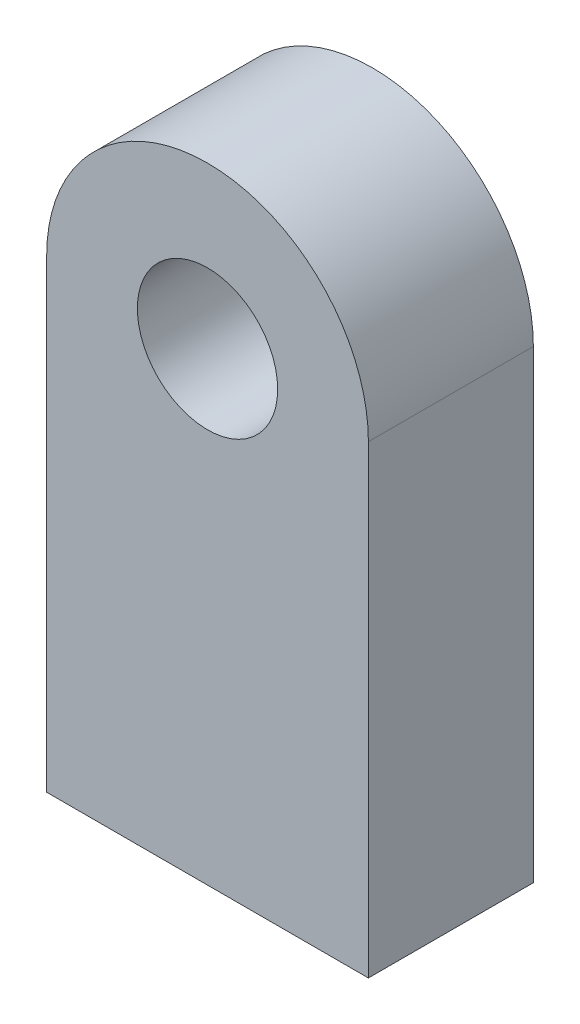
SolidWorks part; units mm, degrees
ref_plane "Front Plane" through (0, 0, 0) normal (0, 0, 1) x (1, 0, 0)
ref_plane "Top Plane" through (0, 0, 0) normal (0, 1, 0) x (1, 0, 0)
ref_plane "Right Plane" through (0, 0, 0) normal (1, 0, 0) x (0, 0, -1)
sketch "Sketch1" plane through (0, 0, 0) normal (0, 0, 1) x (1, 0, 0)
sketch_block_instance "Block1-1"
sketch_block "Block1"
extrude "Extrude1" add sketch "Sketch1" along normal mid plane 10
